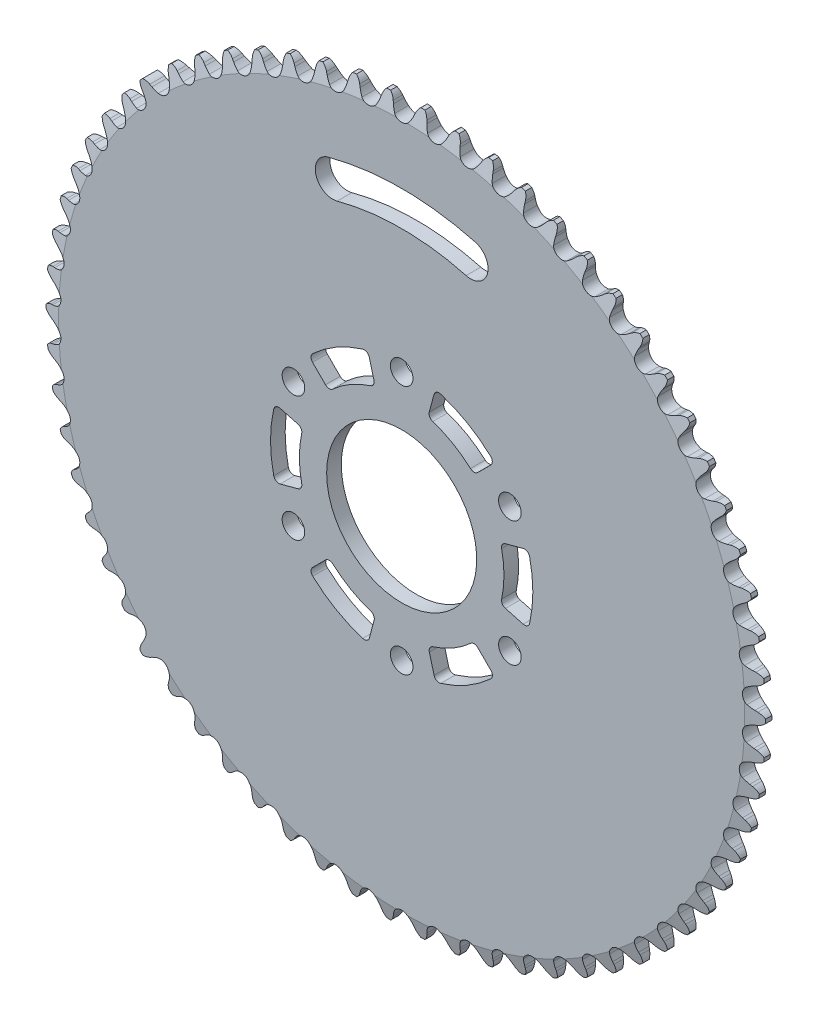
SolidWorks part; units mm, degrees
ref_plane "Front Plane" through (0, 0, 0) normal (0, 0, 1) x (1, 0, 0)
ref_plane "Top Plane" through (0, 0, 0) normal (0, 1, 0) x (1, 0, 0)
ref_plane "Right Plane" through (0, 0, 0) normal (1, 0, 0) x (0, 0, -1)
imported_body "Imported3"
sketch "Sketch1" plane through (0, 0, 0) normal (0, 0, -1) x (-1, 0, 0)
  line L0 (-4.9979, 18.8486) -> (-6.4214, 24.1612)
  line L1 (-17.6956, 17.6597) -> (-13.8065, 13.7706)
  arc A0 (-6.4214, 24.1612) -> (-17.6956, 17.6597) centre (0, 0) ccw
  arc A1 (-13.8065, 13.7706) -> (-4.9979, 18.8486) centre (0, 0) cw
extrude "Cut-Extrude1" cut sketch "Sketch1" against normal through all
sketch "Sketch2" plane through (0, 0, 0) normal (0, 0, -1) x (-1, 0, 0)
  line L0 (-18.8223, 5.096) -> (-24.1349, 6.5195)
  line L1 (-24.1416, -6.495) -> (-18.829, -5.0715)
  arc A0 (-24.1349, 6.5195) -> (-24.1416, -6.495) centre (0, 0) ccw
  arc A1 (-18.829, -5.0715) -> (-18.8223, 5.096) centre (0, 0) cw
extrude "Cut-Extrude2" cut sketch "Sketch2" against normal through all
sketch "Sketch3" plane through (0, 0, 0) normal (0, 0, -1) x (-1, 0, 0)
  line L0 (-13.8245, -13.7526) -> (-17.7136, -17.6417)
  line L1 (-6.4459, -24.1547) -> (-5.0224, -18.8421)
  arc A0 (-17.7136, -17.6417) -> (-6.4459, -24.1547) centre (0, 0) ccw
  arc A1 (-5.0224, -18.8421) -> (-13.8245, -13.7526) centre (0, 0) cw
extrude "Cut-Extrude3" cut sketch "Sketch3" against normal through all
sketch "Sketch4" plane through (0, 0, 0) normal (0, 0, -1) x (-1, 0, 0)
  line L0 (4.9979, -18.8486) -> (6.4214, -24.1612)
  line L1 (17.6956, -17.6597) -> (13.8065, -13.7706)
  arc A0 (6.4214, -24.1612) -> (17.6956, -17.6597) centre (0, 0) ccw
  arc A1 (13.8065, -13.7706) -> (4.9979, -18.8486) centre (0, 0) cw
extrude "Cut-Extrude4" cut sketch "Sketch4" against normal through all
sketch "Sketch5" plane through (0, 0, 0) normal (0, 0, -1) x (-1, 0, 0)
  line L0 (18.8223, -5.096) -> (24.1349, -6.5195)
  line L1 (24.1416, 6.495) -> (18.829, 5.0715)
  arc A0 (24.1349, -6.5195) -> (24.1416, 6.495) centre (0, 0) ccw
  arc A1 (18.829, 5.0715) -> (18.8223, -5.096) centre (0, 0) cw
extrude "Cut-Extrude5" cut sketch "Sketch5" against normal through all
sketch "Sketch6" plane through (0, 0, 2.794) normal (0, 0, 1) x (1, 0, 0)
  line L0 (-5.0224, 18.8421) -> (-6.4459, 24.1547)
  line L1 (-17.7136, 17.6417) -> (-13.8245, 13.7526)
  arc A0 (-13.8245, 13.7526) -> (-5.0224, 18.8421) centre (0, 0) cw
  arc A1 (-6.4459, 24.1547) -> (-17.7136, 17.6417) centre (0, 0) ccw
extrude "Cut-Extrude6" cut sketch "Sketch6" against normal through all
hole_wizard "M4 Clearance Hole1" positions "Sketch8" profile "Sketch7" hole size "M4" standard "ANSI Metric"
sketch "Sketch8" plane through (0, 0, 0) normal (0, 0, -1) x (-1, 0, 0)
  point P0 (20.6222, 11.9063)
  point P1 (20.6222, -11.9062)
  point P2 (0, -23.8125)
  point P3 (-20.6222, -11.9063)
  point P4 (-20.6222, 11.9062)
  point P5 (0, 23.8125)
sketch "Sketch7" plane through (-20.6222, 11.9063, 0) normal (1, 0, 0) x (0, 1, 0)
  line L0 (0, 0) -> (0, 2.794)
  line L1 (0, 2.794) -> (2.1526, 2.794)
  line L2 (2.1526, 2.794) -> (2.1526, 0)
  line L5 (2.1526, 0) -> (0, 0)
  line L11 (0, -6.35) -> (0, 107.95) construction
  dimension "Thru Hole Dia." = 4.3053
  dimension "Thru Hole Depth" = 2.794
hole_wizard "M25 Clearance Hole1" positions "Sketch10" profile "Sketch9" hole size "M25" standard "ANSI Metric"
sketch "Sketch10" plane through (0, 0, 0) normal (0, 0, -1) x (-1, 0, 0)
  point P0 (0, 0)
sketch "Sketch9" plane through (0, 0, 0) normal (1, 0, 0) x (0, 1, 0)
  line L0 (0, 0) -> (0, 2.794)
  line L1 (0, 2.794) -> (14.3, 2.794)
  line L2 (14.3, 2.794) -> (14.3, 0)
  line L5 (14.3, 0) -> (0, 0)
  line L11 (0, -6.35) -> (0, 107.95) construction
  dimension "Thru Hole Dia." = 28.6
  dimension "Thru Hole Depth" = 2.794
fillet "Fillet1" radius 1 24 edges at (13.8245, -13.7526, 1.397) (4.9979, 18.8486, 1.397) (24.1349, 6.5195, 1.397) (-6.4459, 24.1547, 1.397) (5.0224, -18.8421, 1.397) (-5.0224, 18.8421, 1.397) (18.829, -5.0715, 1.397) (-17.7136, 17.6417, 1.397) (13.8065, 13.7706, 1.397) (-13.8245, 13.7526, 1.397) (6.4459, -24.1547, 1.397) (-24.1416, 6.495, 1.397) (17.7136, -17.6417, 1.397) (-18.829, 5.0715, 1.397) (24.1416, -6.495, 1.397) (-24.1349, -6.5195, 1.397) (18.8223, 5.096, 1.397) (-18.8223, -5.096, 1.397) (17.6956, 17.6597, 1.397) (-17.6956, -17.6597, 1.397) (6.4214, 24.1612, 1.397) (-6.4214, -24.1612, 1.397) (-4.9979, -18.8486, 1.397) (-13.8065, -13.7706, 1.397)
sketch "Sketch11" plane through (0, 0, 2.794) normal (0, 0, 1) x (1, 0, 0)
  line L0 (0, 0) -> (-13.148, 49.069) construction
  line L1 (0, 0) -> (13.148, 49.069) construction
  line L2 (0, 0) -> (0, 50.8) construction
  arc A0 (-13.148, 49.069) -> (13.148, 49.069) centre (0, 0) cw construction
  circle A1 centre (0, 0) radius 14.3 construction
  arc A2 (-13.148, 49.069) -> (13.148, 49.069) centre (0, 0) cw construction
  arc A3 (14.0059, 52.2708) -> (-14.0059, 52.2708) centre (0, 0) ccw
  arc A4 (12.2901, 45.8673) -> (-12.2901, 45.8673) centre (0, 0) ccw
  arc A5 (12.2901, 45.8673) -> (14.0059, 52.2708) centre (13.148, 49.069) ccw
  arc A6 (-14.0059, 52.2708) -> (-12.2901, 45.8673) centre (-13.148, 49.069) ccw
  point P6 (0, 50.8)
  point P9 (0, 50.8)
  dimension "D3" = 6.6294
  dimension "D1" = 30
  dimension "D2" = 50.8
extrude "Cut-Extrude7" cut sketch "Sketch11" against normal through all
